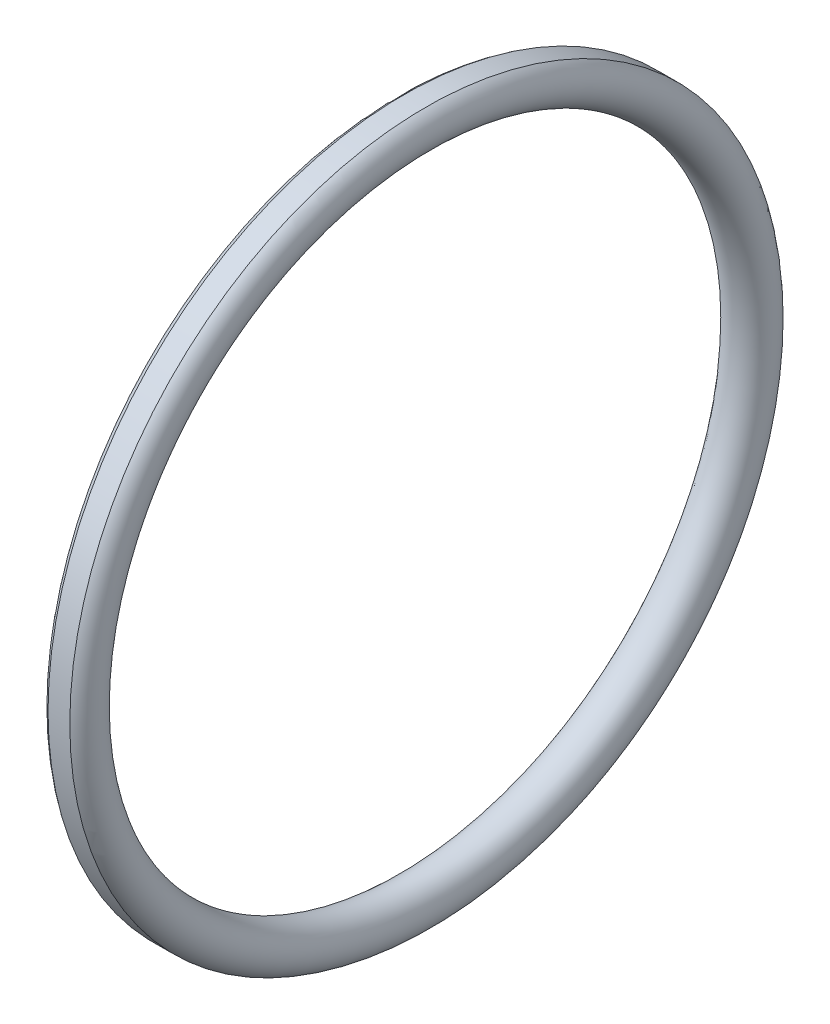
SolidWorks part; units mm, degrees
ref_plane "Face" through (0, 0, 0) normal (0, 0, 1) x (1, 0, 0)
ref_plane "Dessus" through (0, 0, 0) normal (0, 1, 0) x (1, 0, 0)
ref_plane "Droite" through (0, 0, 0) normal (1, 0, 0) x (0, 0, -1)
sketch "Esquisse1" plane through (0, 0, 0) normal (0, 0, 1) x (1, 0, 0)
  line L0 (-14.9506, 0) -> (9.8063, 0) construction
  line L1 (-0.8712, 28.5) -> (0.8712, 28.5)
  line L2 (-1.5, 27.8952) -> (-1.5, 26.0348)
  arc A0 (-0.8712, 28.5) -> (-1.5, 27.8952) centre (0, 26.965) ccw
  arc A1 (-1.5, 26.0348) -> (0.8712, 28.5) centre (0, 26.965) ccw
  dimension "D1" = 3.53
  dimension "D2" = 53.93
  dimension "D3" = 57
  dimension "D4" = 1.5
revolve "Base-Révolution" add sketch "Esquisse1" angle 360 about L0
